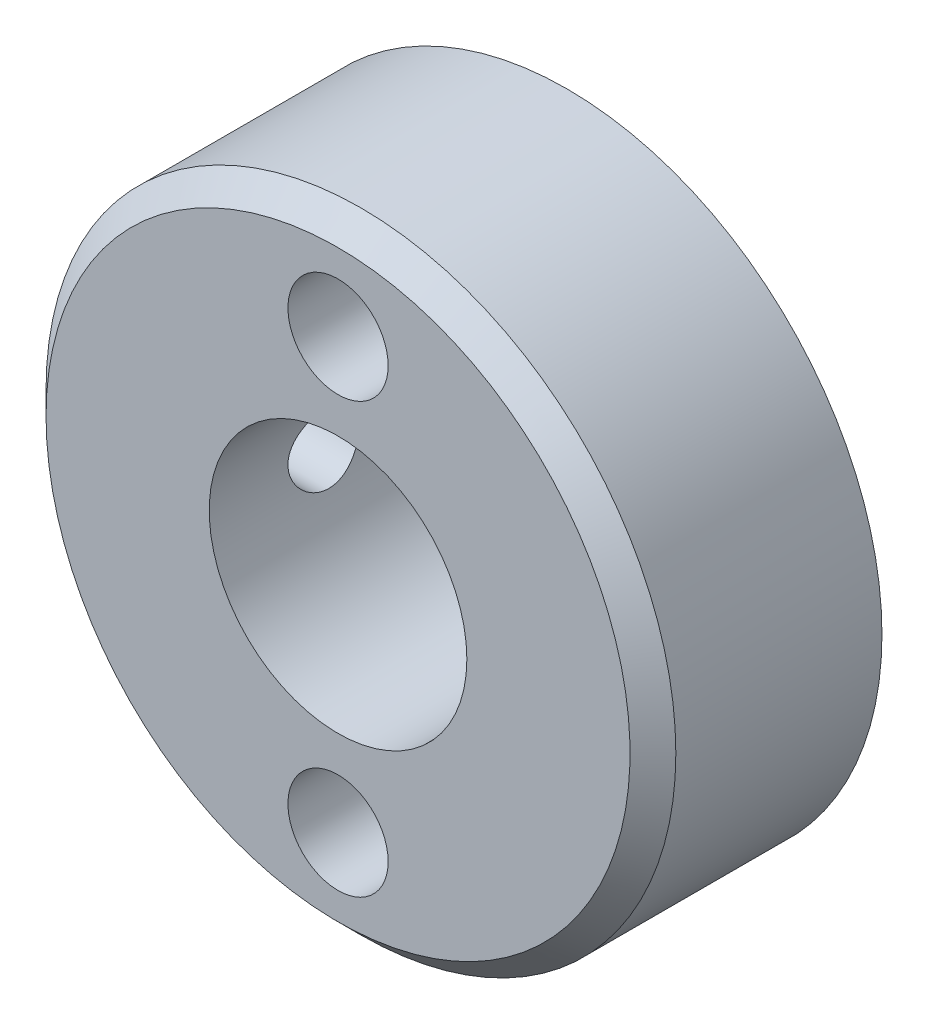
SolidWorks part; units mm, degrees
ref_plane "Front" through (0, 0, 0) normal (0, 0, 1) x (1, 0, 0)
ref_plane "Top" through (0, 0, 0) normal (0, 1, 0) x (1, 0, 0)
ref_plane "Right" through (0, 0, 0) normal (1, 0, 0) x (0, 0, -1)
sketch "Sketch1" plane through (0, 0, 0) normal (0, 0, 1) x (1, 0, 0)
  circle A0 centre (0, 0) radius 11
  circle A1 centre (0, 0) radius 4.5
  dimension "dk" = 22
  dimension "D2" = 9
extrude "BaseNut" add sketch "Sketch1" against normal blind 8
sketch "Sketch5" plane through (0, 0, 0) normal (1, 0, 0) x (0, 0, -1)
  line L0 (-26.3849, 0) -> (32.989, 0) construction
  line L1 (-6.0703, 7.5) -> (6.0703, 7.5) construction
  line L2 (0, 7.5) -> (0, 9.25)
  line L3 (0, 11) -> (0, -11) construction
  line L4 (0, 9.25) -> (4, 9.25)
  line L5 (4, 9.25) -> (5.0104, 7.5)
  line L6 (5.0104, 7.5) -> (0, 7.5)
  dimension "d1" = 3.5
  dimension "D2" = 60
  dimension "t" = 4
  dimension "B" = 15
revolve "Cut-Revolve1" cut sketch "Sketch5" angle 360 about L1
chamfer "Chamfer1" distance 0.8 angle 45 2 edges at (11, 0, 0) (4.5, 0, -8)
sketch "Sketch3" plane through (0, 0, 0) normal (1, 0, 0) x (0, -1, 0)
  circle A0 centre (0, 4) radius 1.25
  dimension "d2" = 2.5
  dimension "K" = 4
extrude "Cut-Extrude1" cut sketch "Sketch3" against normal through all
mirror "Mirror1" about plane through (0, 0, 0) normal (0, 1, 0) of "Cut-Revolve1"
sketch "Sketch6" plane through (0, 0, 0) normal (0, 1, 0) x (1, 0, 0)
  line L0 (0, 11.6242) -> (0, -3.0108) construction
  line L1 (4, 7.45) -> (4, 6.95)
  line L2 (4, 6.95) -> (4.5, 6.95)
  line L3 (4.5, 6.95) -> (4.933, 7.2)
  line L4 (4.933, 7.2) -> (4.5, 7.45)
  line L5 (4.5, 7.45) -> (4, 7.45)
  line L6 (4.5, 7.2) -> (-4.5, 7.2) construction
  dimension "D1" = 0.5
  dimension "D2" = 9
revolve "Cut-Revolve10" [suppressed] cut sketch "Sketch6" angle 360 about L0
pattern_linear "LPattern10" [suppressed] count 13 spacing 0.6 along (0, 0, -1)
equation "\"D2@Sketch6\" = \"D2@Sketch1\""
equation "\"D1@Sketch6\" = (  \"D2@ThreadCosmetic1\" - \"D2@Sketch1\" )  / 2"
equation "\"D3@LPattern10\" = \"D1@Sketch6\" * 1.2"
equation "\"D1@LPattern10\" = \"m@BaseNut\" / \"D3@LPattern10\""
